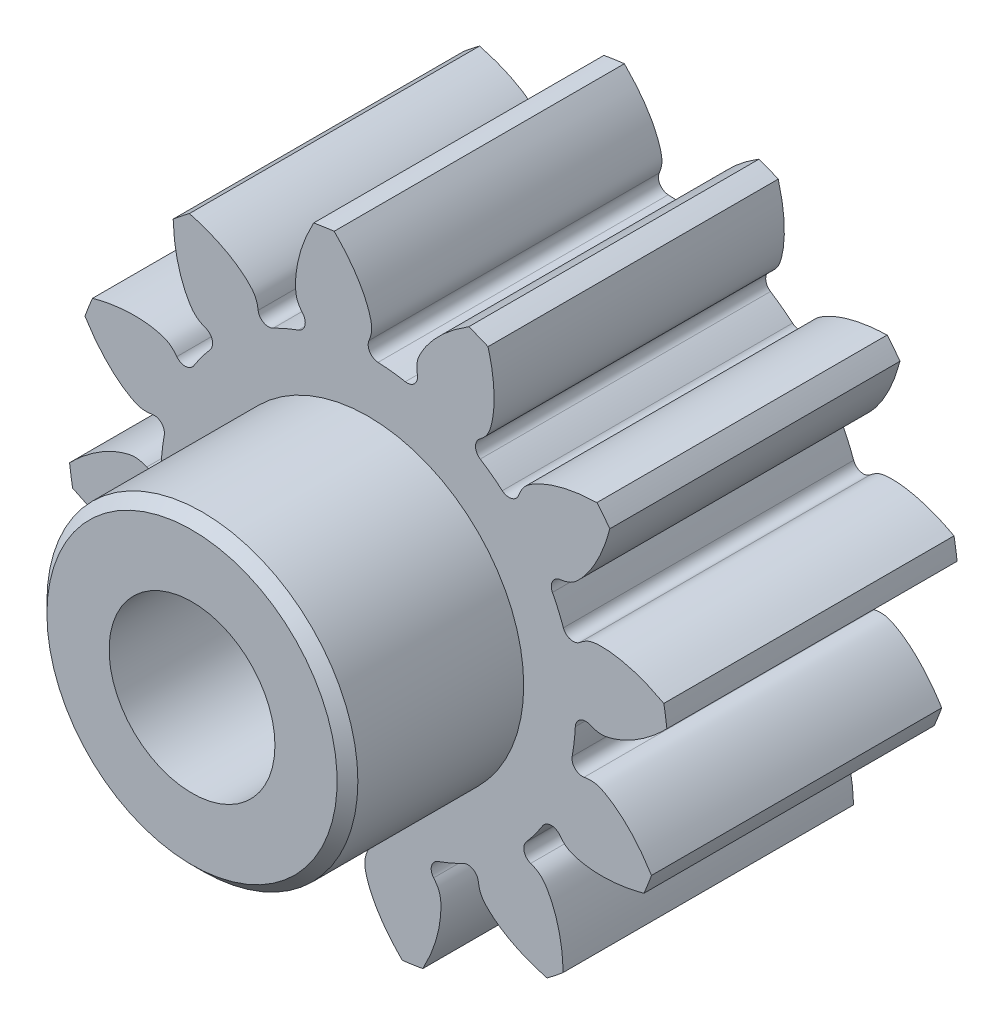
SolidWorks part; units mm, degrees
ref_plane "Face" through (0, 0, 0) normal (0, 0, 1) x (1, 0, 0)
ref_plane "Dessus" through (0, 0, 0) normal (0, 1, 0) x (1, 0, 0)
ref_plane "Droite" through (0, 0, 0) normal (1, 0, 0) x (0, 0, -1)
imported_body "Importée1"
sketch "Esquisse1" plane through (0, 0, 0) normal (0, 0, -1) x (-1, 0, 0)
  circle A0 centre (0, 0) radius 2.4425
  dimension "D1" = 4.885
sketch "Esquisse2" plane through (0, 0, 2.8) normal (0, 0, -1) x (-1, 0, 0)
  circle A0 centre (0, 0) radius 0.8 construction
  circle A1 centre (0, 0) radius 1
  circle A2 centre (0, 0) radius 1
  circle A3 centre (0, 0) radius 0.8
  dimension "D1" = 0
extrude "Extrusion2" add sketch "Esquisse2" along normal up to surface (2.8 mm away)
surface "Surface-primitive" sketch "Esquisse1"
